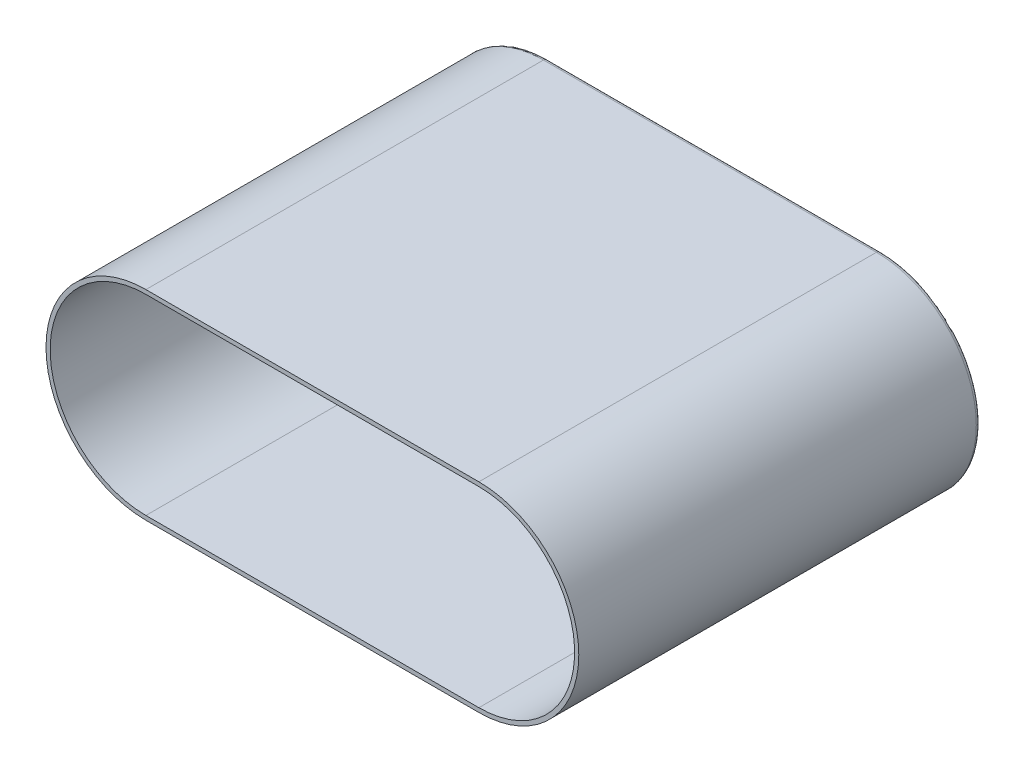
SolidWorks part; units mm, degrees
ref_plane "Front Plane" through (0, 0, 0) normal (0, 0, 1) x (1, 0, 0)
ref_plane "Top Plane" through (0, 0, 0) normal (0, 1, 0) x (1, 0, 0)
ref_plane "Right Plane" through (0, 0, 0) normal (1, 0, 0) x (0, 0, -1)
sketch "Sketch1" plane through (0, 0, 0) normal (0, 0, 1) x (1, 0, 0)
  line L0 (-40, 0) -> (40, 0) construction
  line L1 (-40, 23) -> (40, 23)
  line L2 (-40, -23) -> (40, -23)
  line L3 (-40, 0) -> (40, 0) construction
  line L4 (-40, 24) -> (40, 24)
  line L5 (-40, -24) -> (40, -24)
  arc A0 (-40, 23) -> (-40, -23) centre (-40, 0) ccw
  arc A1 (40, -23) -> (40, 23) centre (40, 0) ccw
  arc A2 (-40, 24) -> (-40, -24) centre (-40, 0) ccw
  arc A3 (40, -24) -> (40, 24) centre (40, 0) ccw
  point P3 (0, 0)
  point P10 (0, 0)
  dimension "D1" = 23
  dimension "D4" = 24
  dimension "D2" = 80
  dimension "D3" = 40
extrude "Boss-Extrude1" add sketch "Sketch1" along normal blind 95
sketch "Sketch2" plane through (0, 0, 0) normal (0, 0, -1) x (-1, 0, 0)
  line L0 (-40, 0) -> (40, 0) construction
  line L1 (-40, 24) -> (40, 24)
  line L2 (-40, -24) -> (40, -24)
  arc A0 (-40, 24) -> (-40, -24) centre (-40, 0) ccw
  arc A1 (40, -24) -> (40, 24) centre (40, 0) ccw
  point P4 (0, 0)
  dimension "D1" = 24
extrude "Boss-Extrude2" add sketch "Sketch2" along normal blind 1.5
fillet "Fillet1" radius 1 4 edges at (0, 24, -1.5) (-64, 0, -1.5) (0, -24, -1.5) (64, 0, -1.5)
